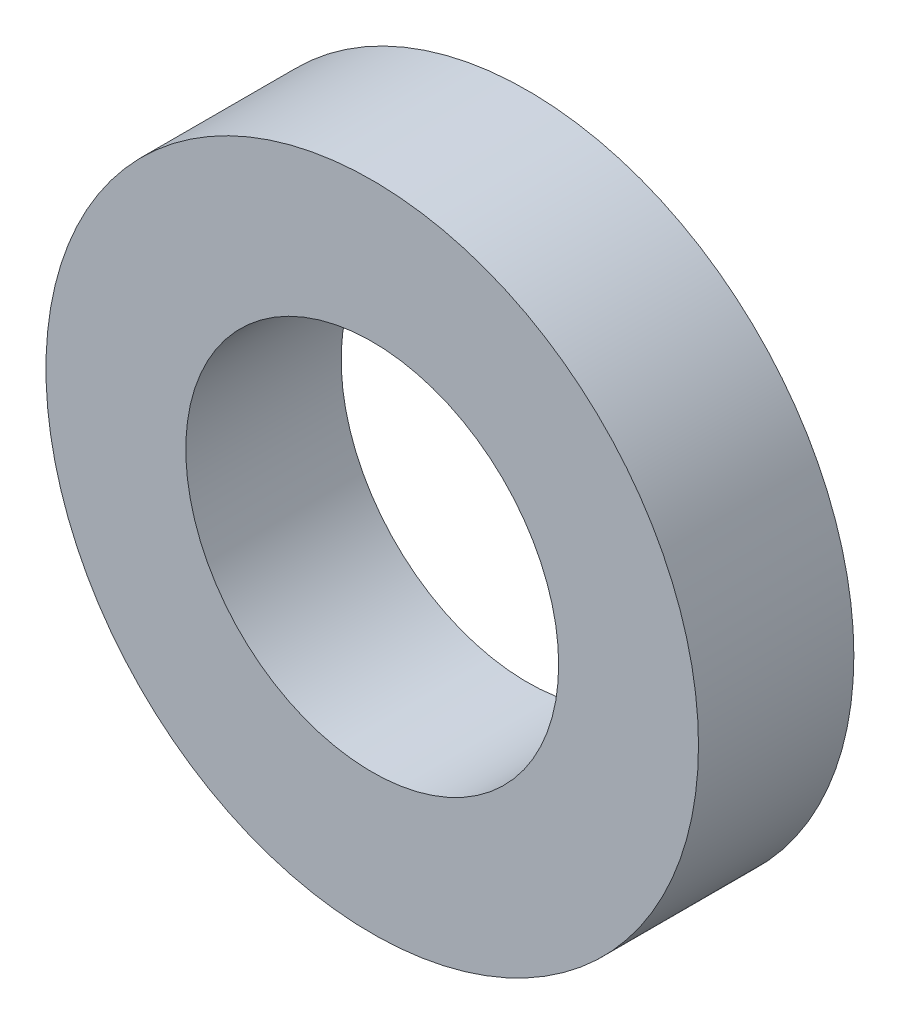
SolidWorks part; units mm, degrees
ref_plane "前视基准面" through (0, 0, 0) normal (0, 0, 1) x (1, 0, 0)
ref_plane "上视基准面" through (0, 0, 0) normal (0, 1, 0) x (1, 0, 0)
ref_plane "右视基准面" through (0, 0, 0) normal (1, 0, 0) x (0, 0, -1)
sketch "草图1" plane through (0, 0, 0) normal (0, 0, 1) x (1, 0, 0)
  circle A0 centre (0, 0) radius 6
  circle A1 centre (0, 0) radius 10.5
  dimension "D1" = 21
  dimension "D2" = 12
extrude "凸台-拉伸1" add sketch "草图1" along normal blind 5
